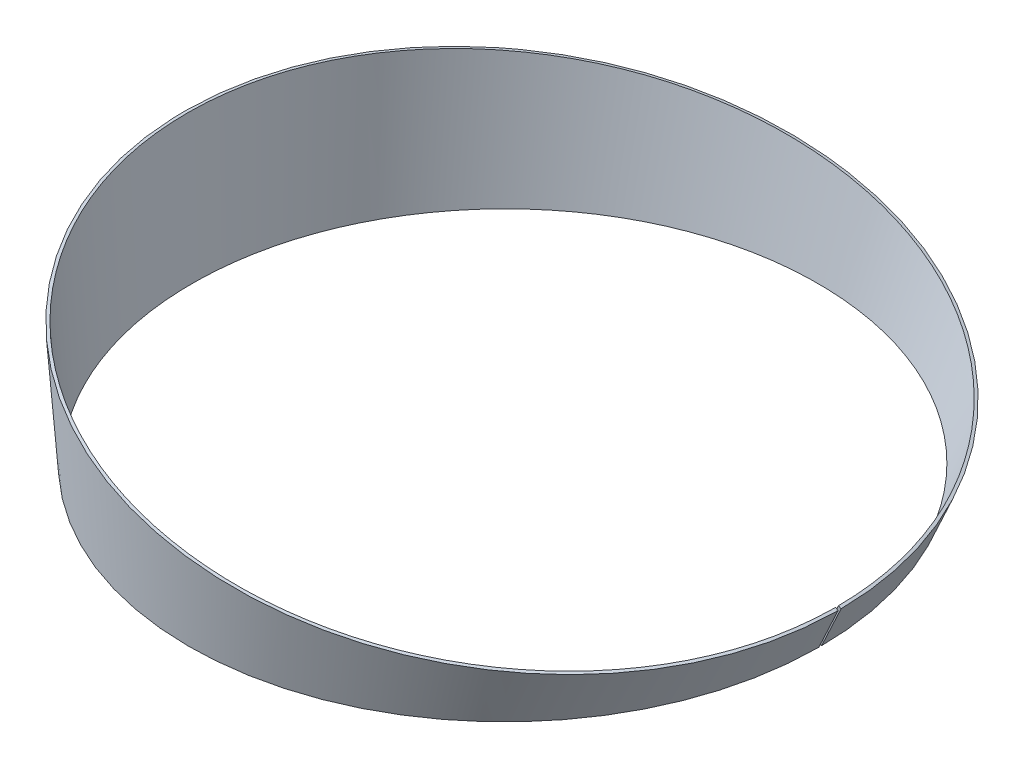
SolidWorks part; units mm, degrees
ref_plane "Ebene vorne" through (0, 0, 0) normal (0, 0, 1) x (1, 0, 0)
ref_plane "Ebene oben" through (0, 0, 0) normal (0, 1, 0) x (1, 0, 0)
ref_plane "Ebene rechts" through (0, 0, 0) normal (1, 0, 0) x (0, 0, -1)
sketch "Skizze1" plane through (0, 0, 0) normal (0, 0, 1) x (1, 0, 0)
  line L0 (0, 0) -> (40, 0) construction
  line L1 (40, 0) -> (0.4925, 6.2574) construction
  arc A0 (0.4925, 6.2574) -> (0, 0) centre (40, 0) ccw
  dimension "D1" = 9
  dimension "D2" = 40
ref_plane "Ebene1" through (0.4925, 6.2574, 0) normal (-0.1564, -0.9877, 0) x (0.9877, -0.1564, 0)
sketch "Skizze2" plane through (0, 0, 0) normal (0, 1, 0) x (1, 0, 0)
  line L0 (21.1058, 0.0921) -> (0, 0) construction
  line L1 (0, 0) -> (21.1058, -0.0921) construction
  line L2 (21.1058, -0.0921) -> (21.1058, 0.0921) construction
  arc A0 (21.1058, 0.0921) -> (21.1058, -0.0921) centre (0, 0) ccw
  dimension "D1" = 42.212
  dimension "D2" = 0.5
sketch "Skizze3" plane through (0.4925, 6.2574, 0) normal (-0.1564, -0.9877, 0) x (0.9877, -0.1564, 0)
  line L0 (22.1848, -0.0968) -> (0, 0) construction
  line L1 (0, 0) -> (22.1848, 0.0968) construction
  line L2 (22.1848, 0.0968) -> (22.1848, -0.0968) construction
  arc A0 (22.1848, 0.0968) -> (22.1848, -0.0968) centre (0, 0) ccw
  dimension "D1" = 44.37
  dimension "D2" = 0.5
sheet metal parameters "Blech1" thickness 0.2 parameters "D1"=2, "Dicke"=0.2
lofted bend "Ausgeformte Biegungen1" parameters "D1"=0, "D12"=0.2
other "Freiform-Biegung1" parameters "D1"=1000, "D4"=57.296, "D5"=1
flat pattern "Abwicklung1"
sketch "Biegung-Linien1" plane through (0, 0, 0) normal (0, 1, 0) x (-1, 0, 0)
other "Abwickeln-<Freiform-Biegung1>1"
